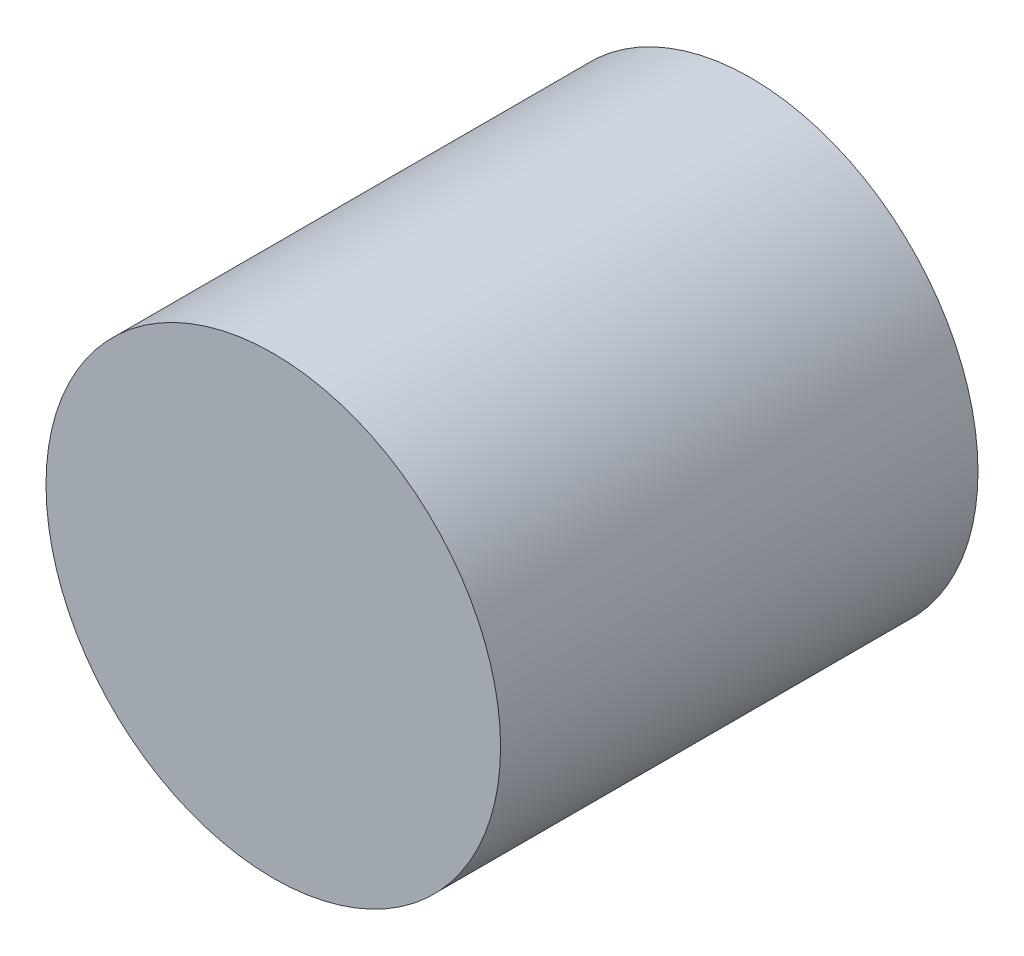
SolidWorks part; units mm, degrees
ref_plane "Front Plane" through (0, 0, 0) normal (0, 0, 1) x (1, 0, 0)
ref_plane "Top Plane" through (0, 0, 0) normal (0, 1, 0) x (1, 0, 0)
ref_plane "Right Plane" through (0, 0, 0) normal (1, 0, 0) x (0, 0, -1)
sketch "Sketch1"
extrude "Extrude1" add sketch "Sketch1" against normal blind 14.478
